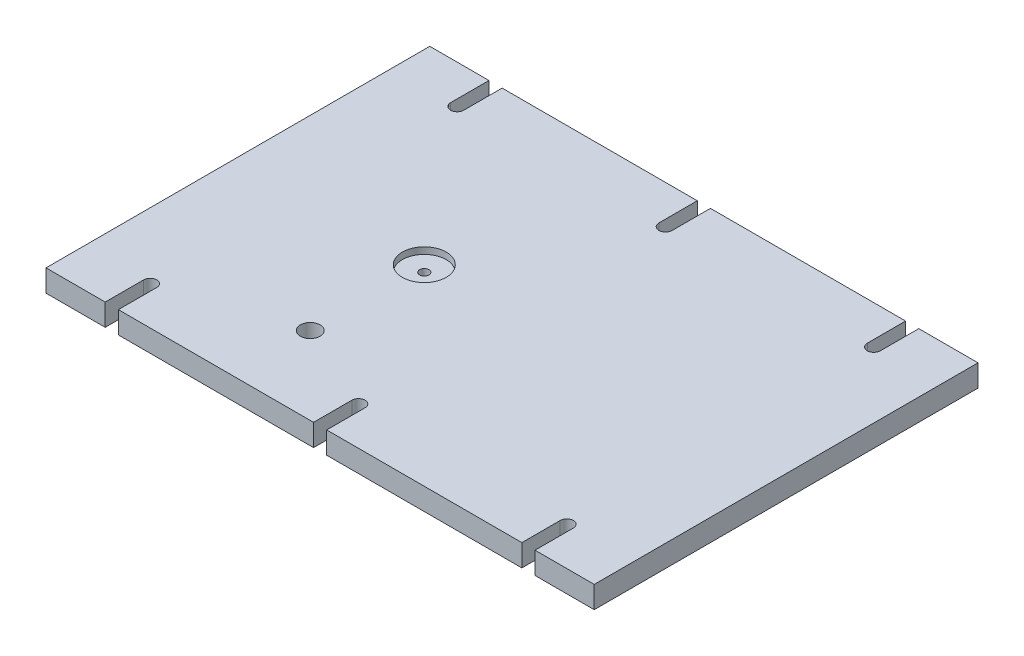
SolidWorks part; units mm, degrees
ref_plane "Face" through (0, 0, 0) normal (0, 0, 1) x (1, 0, 0)
ref_plane "Dessus" through (0, 0, 0) normal (0, 1, 0) x (1, 0, 0)
ref_plane "Droite" through (0, 0, 0) normal (1, 0, 0) x (0, 0, -1)
sketch "Esquisse1" plane through (0, 0, 0) normal (0, 0, 1) x (1, 0, 0)
  line L1 (-200, 0) -> (300, 0)
  line L2 (-200, 0) -> (-200, -20)
  line L3 (-200, -20) -> (300, -20)
  line L4 (300, 0) -> (300, -20)
  dimension "D1" = 20
  dimension "D2" = 200
  dimension "D3" = 500
extrude "Extrusion1" add sketch "Esquisse1" along normal mid plane 350
hole_wizard "Trou taraudé M10x1.51" positions "Esquisse3" profile "Esquisse2" tap size "M10x1.5" standard "Ansi Métrique"
sketch "Esquisse3" plane through (0, 0, 0) normal (0, 1, 0) x (-1, 0, 0)
  point P0 (30, 0)
  point P1 (30, 0)
sketch "Esquisse2" plane through (-30, 0, 0) normal (1, 0, 0) x (0, 0, 1)
  line L0 (0, 0) -> (0, 20)
  line L1 (0, 20) -> (4.25, 20)
  line L2 (4.25, 20) -> (4.25, 0)
  line L5 (4.25, 0) -> (0, 0)
  line L11 (0, -6.35) -> (0, 107.95) construction
  dimension "Diamètre du trou pour taraudage jusqu'au prochain" = 8.5
  dimension "Profondeur du trou pour taraudage jusqu'au prochain" = 20
sketch "Esquisse4" plane through (0, 0, 0) normal (0, 1, 0) x (1, 0, 0)
  circle A0 centre (-30, -104) radius 9
  circle A1 centre (-30, 0) radius 4.25 construction
  dimension "D1" = 18
  dimension "D2" = 104
  dimension "D3" = 30
extrude "Enlèv. mat.-Extru.2" cut sketch "Esquisse4" against normal through all
sketch "Esquisse5" plane through (0, 0, 0) normal (0, 1, 0) x (1, 0, 0)
  circle A0 centre (-30, 0) radius 20
  dimension "D1" = 40
extrude "Enlèv. mat.-Extru.3" cut sketch "Esquisse5" against normal blind 6
sketch "Esquisse6" plane through (0, 0, 0) normal (0, 1, 0) x (1, 0, 0)
  line L0 (300, -175) -> (-200, -175) construction
  line L1 (-146, -175) -> (-134, -175)
  line L2 (-146, -175) -> (-146, -140)
  line L3 (234, -175) -> (234, -140)
  line L4 (-134, -175) -> (-134, -140)
  line L5 (50, -175) -> (50, 195.3141) construction
  line L6 (-200, 0) -> (230.2462, 0) construction
  line L7 (-200, -175) -> (-200, 175) construction
  line L8 (246, -175) -> (246, -140)
  line L9 (246, -175) -> (234, -175)
  line L10 (246, 175) -> (234, 175)
  line L11 (246, 175) -> (246, 140)
  line L12 (-134, 175) -> (-134, 140)
  line L13 (234, 175) -> (234, 140)
  line L14 (-146, 175) -> (-146, 140)
  line L15 (-146, 175) -> (-134, 175)
  line L16 (56, 175) -> (56, 140)
  line L17 (44, -175) -> (56, -175)
  line L18 (44, -175) -> (44, -140)
  line L19 (44, 175) -> (44, 140)
  line L20 (56, -175) -> (56, -140)
  line L21 (44, 175) -> (56, 175)
  arc A0 (-146, -140) -> (-134, -140) centre (-140, -140) cw
  arc A1 (246, -140) -> (234, -140) centre (240, -140) ccw
  arc A2 (246, 140) -> (234, 140) centre (240, 140) cw
  arc A3 (-146, 140) -> (-134, 140) centre (-140, 140) ccw
  arc A4 (56, -140) -> (44, -140) centre (50, -140) ccw
  arc A5 (56, 140) -> (44, 140) centre (50, 140) cw
  dimension "D1" = 12
  dimension "D2" = 35
  dimension "D3" = 190
  dimension "D4" = 12
  dimension "D5" = 35
extrude "Enlèv. mat.-Extru.4" cut sketch "Esquisse6" against normal through all
